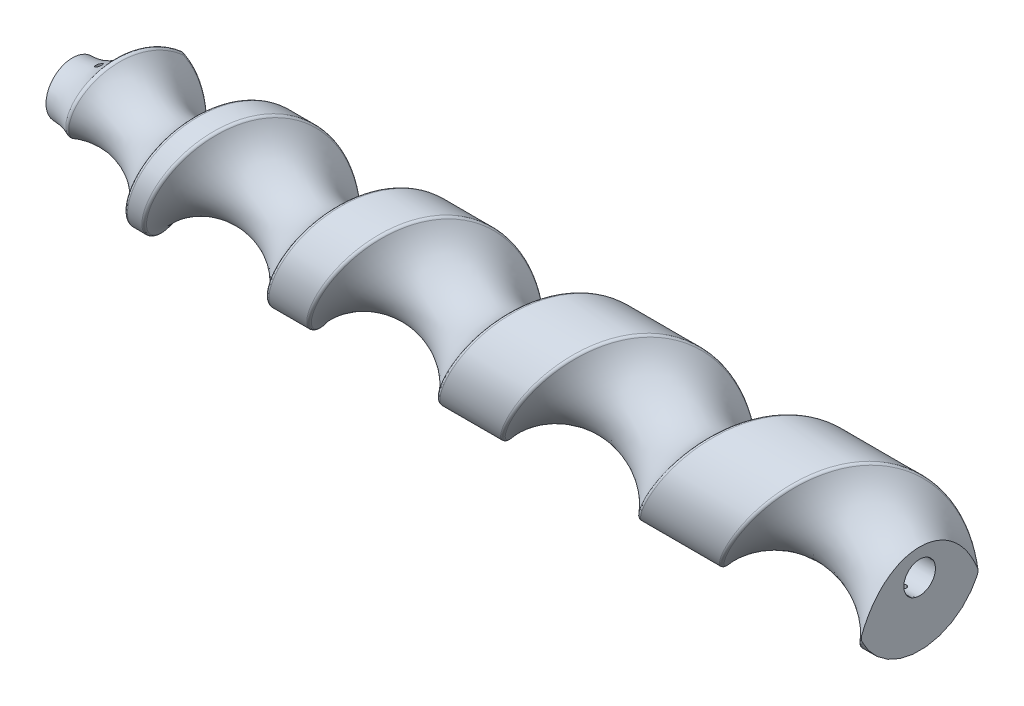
SolidWorks part; units mm, degrees
ref_plane "Vorne" through (0, 0, 0) normal (0, 0, 1) x (1, 0, 0)
ref_plane "Oben" through (0, 0, 0) normal (0, 1, 0) x (1, 0, 0)
ref_plane "Rechts" through (0, 0, 0) normal (1, 0, 0) x (0, 0, -1)
sketch "Skizze1" plane through (0, 0, 0) normal (0, 0, -1) x (1, 0, 0)
  line L0 (-89, 0) -> (1194.0237, 0) construction
  line L2 (0, 0) -> (800, 0)
  line L3 (0, -25) -> (0, 0)
  line L4 (49.1426, -60) -> (800, -60)
  line L5 (0, -25) -> (1009.55, -25) construction
  line L9 (800, -60) -> (800, 0)
  circle A0 centre (1009.55, -77) radius 49.5 construction
  circle A1 centre (1009.55, -77) radius 52 construction
  arc A2 (49.1426, -60) -> (0, -25) centre (0, -77) ccw
  dimension "D5" = 2.5
  dimension "øD max." = 99
  dimension "D6" = 154
  dimension "D2" = 104
  dimension "D1" = 104
  dimension "L" = 800
  dimension "øA" = 120
  dimension "øK" = 50
  dimension "AS" = 209.55
revolve "Rotation1" add sketch "Skizze1" angle 360 about L0
hole_wizard "Ø30.0 (30) Durchmesser Bohrung1" positions "Skizze12" profile "Skizze11" hole size "Ø30.0" standard "DIN"
sketch "Skizze12" plane through (800, 0, 0) normal (1, 0, 0) x (0, 0, -1)
  circle A0 centre (0, 0) radius 60 construction
  point P0 (0, 0)
sketch "Skizze11" plane through (800, 0, 0) normal (0, 1, 0) x (0, 0, -1)
  line L0 (0, 0) -> (0, 99.0129)
  line L1 (0, 99.0129) -> (15, 90)
  line L2 (15, 90) -> (15, 0)
  line L5 (15, 0) -> (0, 0)
  line L10 (0, 99.0129) -> (-15, 90) construction
  line L11 (0, -6.35) -> (0, 107.95) construction
  dimension "Bohrerdurchmesser" = 30
  dimension "Bohrungstiefe" = 90
  dimension "Spitzenwinkel" = 118
hole_wizard "Ø20.0 (20) Durchmesser Bohrung1" positions "Skizze14" profile "Skizze13" hole size "Ø20.0" standard "DIN"
sketch "Skizze14" plane through (0, 0, 0) normal (-1, 0, 0) x (0, 0, 1)
  point P0 (0, 0)
sketch "Skizze13" plane through (0, 0, 0) normal (0, 1, 0) x (0, 0, 1)
  line L0 (0, 0) -> (0, 700.9871)
  line L1 (0, 700.9871) -> (10, 700.9871)
  line L2 (10, 700.9871) -> (10, 0)
  line L5 (10, 0) -> (0, 0)
  line L11 (0, -6.35) -> (0, 107.95) construction
  dimension "Bohrerdurchmesser" = 20
  dimension "Bohrungstiefe" = 700.9871
hole_wizard "Ø6.0 (6) Durchmesser Bohrung1" positions "3D-Skizze1" profile "Skizze15" hole size "Ø6.0" standard "DIN"
sketch3d "3D-Skizze1"
  point P0 (25, -60, 0)
  dimension "D1" = 25
sketch "Skizze15" plane through (25, -60, 0) normal (1, 0, 0) x (0, 0, -1)
  line L0 (0, 0) -> (0, 120)
  line L1 (0, 120) -> (3, 120)
  line L2 (3, 120) -> (3, 0)
  line L5 (3, 0) -> (0, 0)
  line L11 (0, -6.35) -> (0, 107.95) construction
  dimension "Bohrerdurchmesser" = 6
  dimension "Bohrungstiefe" = 120
hole_wizard "Bohrung1" positions "3D-Skizze2" profile "Skizze16" legacy
sketch3d "3D-Skizze2"
  point P0 (785, -60, 0)
  dimension "D1" = 15
sketch "Skizze16" plane through (785, -60, 0) normal (1, 0, 0) x (0, 0, -1)
  line L0 (0, 0) -> (0, 46.5022)
  line L1 (0, 46.5022) -> (2.5, 45)
  line L2 (2.5, 45) -> (2.5, 17)
  line L3 (2.5, 17) -> (5.5, 17)
  line L4 (5.5, 0) -> (0, 0)
  line L5 (0, -11.3109) -> (0, 121.1557) construction
  line L6 (0, 46.5022) -> (-2.5, 45) construction
  line L7 (5.5, 17) -> (5.5, 0)
  dimension "Durchmesser" = 5
  dimension "Tiefe" = 45
  dimension "Senkdurchmesser3" = 11
  dimension "Senktiefe1" = 17
  dimension "Spitzenwinkel" = 118
ref_plane "Ebene3" through (1009.55, 0, 0) normal (1, 0, 0) x (0, 0, -1)
sketch "Skizze9" plane through (1009.55, 0, 0) normal (1, 0, 0) x (0, 0, -1)
  circle A0 centre (0, 0) radius 77
  dimension "D1" = 154
ref_plane "Ebene4" through (0, 77, 0) normal (0, 1, 0) x (-1, 0, 0)
sketch "Skizze10" plane through (0, 77, 0) normal (0, 1, 0) x (-1, 0, 0)
  line L0 (-1009.55, -49) -> (-1009.55, 49)
  point P2 (-1009.55, 0)
  dimension "Pröbelmass (möglichst gross)" = 98
curve "Spirale/Helix5" parameters "D10001"=419.1, "D30001"=154, "D40001"=209.55, "D10002"=590.45, "D30002"=154, "D40002"=104, "D50000"=209.55
surface "Oberfläche-Austragung3"
thicken "Schnitt-Wanddicke auftragen4" thickness 52 parameters "D1"=52
fillet "Verrundung2" radius 3 4 edges at (800, 24.9987, 0.2513) (361.9917, 32.3346, -50.5418) (23.6787, -11.7944, 28.3483) (342.7933, -35.0526, -48.6962)
fillet "Verrundung3" radius 3 7 edges at (18.2658, 5.8107, -27.711) (23.6787, -11.7944, 28.3483) (342.0482, -34.4131, -47.1796) (49.1426, 32.2357, -50.605) (368.6386, 16.1141, -57.7956) (49.0885, 36.5639, -47.3753) (48.8221, 23.8355, -54.0806)
sketch "für die Überprüfung" plane through (0, 0, 0) normal (0, 0, 1) x (1, 0, 0)
  line L0 (72.8189, 77) -> (-72.8189, 77) construction
  line L1 (800, 60) -> (800, 0) construction
  line L2 (800, 77) -> (1009.55, 77) construction
  line L3 (800, 77) -> (590.45, 77) construction
  circle A0 centre (800, 77) radius 52
  circle A1 centre (590.45, 77) radius 52
  circle A2 centre (0, 77) radius 52 construction
  circle A4 centre (-104, 77) radius 52 construction
  circle A5 centre (1009.55, 77) radius 52
  circle A6 centre (1009.55, 77) radius 52 construction
  dimension "D1" = 104
  dimension "D4" = 104
  dimension "D5" = 209.55
  dimension "D2" = 209.55
equation "\"D50000@Spirale/Helix5\" = \"AS@Skizze1\""
equation "\"D40001@Spirale/Helix5\" = \"AS@Skizze1\""
equation "\"D10001@Spirale/Helix5\" = 2*\"AS@Skizze1\""
equation "\"D10002@Spirale/Helix5\" = \"L@Skizze1\"-\"AS@Skizze1\""
equation "\"D30001@Spirale/Helix5\" = \"D6@Skizze1\""
equation "\"D30002@Spirale/Helix5\" = \"D6@Skizze1\""
equation "\"D1@Schnitt-Wanddicke auftragen4\" = \"D2@Skizze1\"/2"
equation "\"D1@Skizze1\" = \"øD max.@Skizze1\"+2*\"D5@Skizze1\""
equation "\"D40002@Spirale/Helix5\" = \"D1@Skizze1\""
